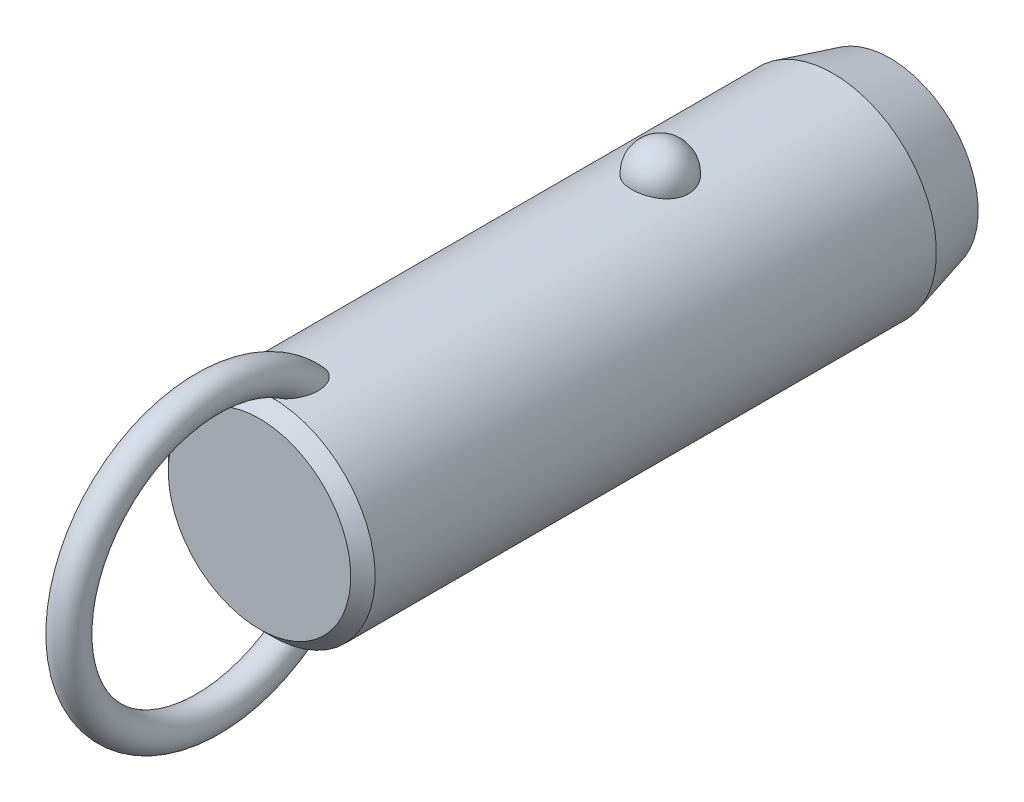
SolidWorks part; units mm, degrees
ref_plane "Front Plane" through (0, 0, 0) normal (0, 0, 1) x (1, 0, 0)
ref_plane "Top Plane" through (0, 0, 0) normal (0, 1, 0) x (1, 0, 0)
ref_plane "Right Plane" through (0, 0, 0) normal (1, 0, 0) x (0, 0, -1)
sketch "Sketch2" plane through (0, 0, 0) normal (0, 0, 1) x (1, 0, 0)
  circle A0 centre (0, 0) radius 12.7
  point P3 (0, 12.7)
  dimension "D1" = 25.4
extrude "Boss-Extrude1" add sketch "Sketch2" along normal blind 33
sketch "Sketch3" plane through (0, 0, 0) normal (0, 0, -1) x (-1, 0, 0)
  circle A0 centre (0, 0) radius 12.7
  dimension "D1" = 25.4
extrude "Boss-Extrude2" add sketch "Sketch3" along normal blind 31.7
chamfer "Chamfer1" distance 7 angle 15 1 edges at (-12.7, 0, -31.7)
sketch "Sketch12" plane through (0, 0, 0) normal (1, 0, 0) x (0, 0, -1)
  line L0 (-33, 12.7) -> (-33, -12.7) construction
  point P0 (-33, 0)
sketch "Sketch13" plane through (0, 0, 0) normal (1, 0, 0) x (0, 0, -1)
  circle A0 centre (-52.05, 0) radius 19.05
  point P2 (-33, 0)
  dimension "D1" = 38.1
sketch "Sketch14" plane through (0, 0, 0) normal (0, 1, 0) x (1, 0, 0)
  circle A0 centre (0, -35) radius 2
  point P2 (0, -33)
  dimension "D1" = 4
sweep "Sweep1" add profiles "Sketch14" path "Sketch13"
sketch "Sketch15" plane through (0, 0, 33) normal (0, 0, 1) x (1, 0, 0)
  circle A0 centre (0, 0) radius 12.7
  dimension "D1" = 25.4
extrude "Boss-Extrude3" add sketch "Sketch15" along normal blind 12.7
chamfer "Chamfer2" distance 1.5 angle 45 1 edges at (12.7, 0, 45.7)
sketch "Sketch18" plane through (0, 0, 0) normal (1, 0, 0) x (0, 0, -1)
  line L0 (24.7, 12.7) -> (-37.851, 12.7) construction
  line L1 (3.5, 16.2) -> (3.5, 9.2)
  line L2 (-37.851, -12.7) -> (24.7, -12.7) construction
  arc A0 (3.5, 16.2) -> (3.5, 9.2) centre (3.5, 12.7) ccw
  point P4 (0, 12.7)
  dimension "D1" = 28.9
revolve "Revolve1" add sketch "Sketch18" angle 360 about L1
